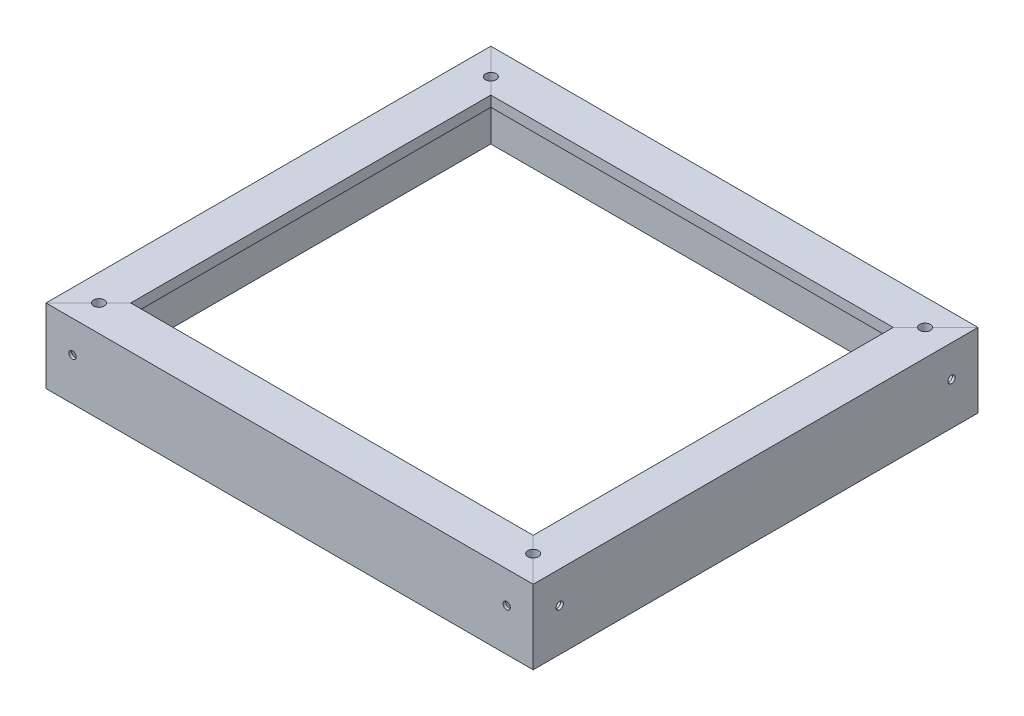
SolidWorks part; units mm, degrees
ref_plane "Front Plane" through (0, 0, 0) normal (0, 0, 1) x (1, 0, 0)
ref_plane "Top Plane" through (0, 0, 0) normal (0, 1, 0) x (1, 0, 0)
ref_plane "Right Plane" through (0, 0, 0) normal (1, 0, 0) x (0, 0, -1)
sketch "Sketch1" plane through (0, 0, 0) normal (0, 0, 1) x (1, 0, 0)
  line L0 (-73.025, 0) -> (-73.025, -22.225)
  line L1 (-73.025, 0) -> (-60.325, 0)
  line L2 (-69.85, -3.175) -> (-60.325, -3.175)
  line L3 (-69.85, -3.175) -> (-69.85, -22.225)
  line L4 (-60.325, 0) -> (-60.325, -3.175)
  line L5 (-69.85, -22.225) -> (-73.025, -22.225)
  dimension "D1" = 12.7
  dimension "D2" = 22.225
  dimension "D3" = 73.025
  dimension "D4" = 3.175
  dimension "D5" = 3.175
sketch "Sketch2" plane through (0, 0, 0) normal (0, 1, 0) x (1, 0, 0)
  line L1 (-73.025, 66.675) -> (73.025, 66.675)
  line L2 (-73.025, 66.675) -> (-73.025, -66.675)
  line L3 (-73.025, -66.675) -> (73.025, -66.675)
  line L4 (73.025, 66.675) -> (73.025, -66.675)
  line L5 (-73.025, 66.675) -> (73.025, -66.675) construction
  line L6 (-73.025, -66.675) -> (73.025, 66.675) construction
  point P1 (0, 0)
  dimension "D1" = 146.05
  dimension "D2" = 133.35
sweep "Sweep1" add profiles "Sketch1" path "Sketch2"
sketch "Sketch3" plane through (0, 0, 0) normal (0, 1, 0) x (1, 0, 0)
  line L2 (60.325, -53.975) -> (-60.325, -53.975) construction
  line L3 (-60.325, -53.975) -> (-60.325, 0) construction
  circle A0 centre (-65.0875, -58.7375) radius 1.59
  dimension "D1" = 3.1801
  dimension "D3" = 4.7625
  dimension "D2" = 4.7625
extrude "Cut-Extrude1" cut sketch "Sketch3" against normal through all
pattern_linear "LPattern1" count 2 spacing 130.175 along (1, 0, 0) count 2 spacing 117.475 along (0, 0, -1) of "Cut-Extrude1"
sketch "Sketch5" plane through (0, 0, 0) normal (0, 0, 1) x (1, 0, 0)
  line L6 (-73.025, 0) -> (-73.025, -22.225)
  line L7 (-73.025, -22.225) -> (-69.85, -22.225)
  line L8 (-69.85, -22.225) -> (-69.85, -3.175)
  line L9 (-69.85, -3.175) -> (-60.325, -3.175)
  line L10 (-60.325, -3.175) -> (-60.325, 0)
  line L11 (-60.325, 0) -> (-73.025, 0)
  line L12 (-73.025, 0) -> (-73.025, -22.225)
  line L13 (-73.025, -22.225) -> (-69.85, -22.225)
  line L14 (-69.85, -22.225) -> (-69.85, -3.175)
  line L15 (-69.85, -3.175) -> (-60.325, -3.175)
  line L16 (-60.325, -3.175) -> (-60.325, 0)
  line L17 (-60.325, 0) -> (-73.025, 0)
  dimension "D1" = 0
extrude "Boss-Extrude1" add sketch "Sketch5" along normal mid plane 2.54
ref_plane "Plane1" through (0, 0, 58.7248) normal (0, 0, 1) x (1, 0, 0)
sketch "Sketch6" plane through (0, 0, 58.7248) normal (0, 0, 1) x (1, 0, 0)
  line L0 (-69.85, -3.175) -> (-69.85, -22.225) construction
  line L1 (-69.85, -22.225) -> (69.85, -22.225) construction
  line B0 (-76.6251, -8.4298) -> (-76.6251, -9.525) construction
  line B1 (-69.85, -8.896) -> (-69.85, -9.525)
  line B2 (-72.2309, -8.435) -> (-72.2309, -9.525) construction
  line B3 (-72.2309, -8.435) -> (-76.6251, -8.4298)
  line B4 (-69.85, -7.1437) -> (-69.85, -8.896)
  line B5 (-72.2309, -8.435) -> (-69.85, -7.1437)
  line B6 (-69.85, -8.896) -> (-70.7252, -9.5198) construction
  line B7 (-70.7177, -9.525) -> (-70.7252, -9.5198)
  line B8 (-82.5895, -9.525) -> (-69.85, -9.525)
  ellipse B9 centre (-81.3837, -9.913) end of major axis (-81.3837, -9.2127) minor radius 0.5602 (-80.9963, -9.4071) -> (-81.8127, -9.4626) ccw
  ellipse B10 centre (-82.2906, -11.5744) end of major axis (-82.1007, -9.3588) minor radius 1.1214 (-81.8127, -9.4626) -> (-82.5895, -9.525) ccw
  ellipse B11 centre (-76.6528, -9.3774) end of major axis (-76.6528, -8.4292) minor radius 0.7586 (-76.6251, -8.4298) -> (-77.3955, -9.1841) ccw
  ellipse B12 centre (-78.4909, -9.2536) end of major axis (-78.4909, -8.7968) minor radius 0.3655 (-78.1444, -9.1085) -> (-78.8562, -9.2416) ccw
  ellipse B13 centre (-77.769, -9.131) end of major axis (-77.769, -8.6612) minor radius 0.3759 (-77.3955, -9.1841) -> (-78.1444, -9.1085) ccw
  ellipse B14 centre (-79.216, -9.3415) end of major axis (-79.216, -8.8809) minor radius 0.3686 (-78.8562, -9.2416) -> (-79.5796, -9.266) ccw
  ellipse B15 centre (-80.6327, -9.5928) end of major axis (-80.6327, -9.1018) minor radius 0.3928 (-80.2903, -9.3521) -> (-80.9963, -9.4071) ccw
  ellipse B16 centre (-79.9234, -9.4582) end of major axis (-79.9234, -8.9874) minor radius 0.3766 (-79.5796, -9.266) -> (-80.2903, -9.3521) ccw
  dimension "D1" = 12.7
sketch_block_instance "Block1-1"
sketch_block "Block1" parameters "D1"=2.3813, "D2"=12.7395, "D3"=0.7768, "D4"=0.8164, "D5"=0.7059, "D6"=12.7395
revolve "Cut-Revolve1" cut sketch "Sketch6" angle 360 about L8
pattern_linear "LPattern2" count 2 spacing 117.4496 along (0, 0, -1) of "Cut-Revolve1"
mirror "Mirror1" about plane through (0, 0, 0) normal (1, 0, 0) of "LPattern2", "Cut-Revolve1"
ref_plane "Plane3" through (-65.0748, 0, 0) normal (1, 0, 0) x (0, 0, -1)
sketch "Sketch7" plane through (-65.0748, 0, 0) normal (1, 0, 0) x (0, 0, -1)
  line L0 (-63.5, -22.225) -> (63.5, -22.225) construction
  line L1 (-63.5, -3.175) -> (-63.5, -22.225) construction
  line B0 (-70.2751, -8.4298) -> (-70.2751, -9.525) construction
  line B1 (-63.5, -8.896) -> (-63.5, -9.525)
  line B2 (-65.8809, -8.435) -> (-65.8809, -9.525) construction
  line B3 (-65.8809, -8.435) -> (-70.2751, -8.4298)
  line B4 (-63.5, -7.1437) -> (-63.5, -8.896)
  line B5 (-65.8809, -8.435) -> (-63.5, -7.1437)
  line B6 (-63.5, -8.896) -> (-64.3752, -9.5198) construction
  line B7 (-64.3677, -9.525) -> (-64.3752, -9.5198)
  line B8 (-76.2395, -9.525) -> (-63.5, -9.525)
  ellipse B9 centre (-75.0337, -9.913) end of major axis (-75.0337, -9.2127) minor radius 0.5602 (-74.6463, -9.4071) -> (-75.4627, -9.4626) ccw
  ellipse B10 centre (-75.9406, -11.5744) end of major axis (-75.7507, -9.3588) minor radius 1.1214 (-75.4627, -9.4626) -> (-76.2395, -9.525) ccw
  ellipse B11 centre (-70.3028, -9.3774) end of major axis (-70.3028, -8.4292) minor radius 0.7586 (-70.2751, -8.4298) -> (-71.0455, -9.1841) ccw
  ellipse B12 centre (-72.1409, -9.2536) end of major axis (-72.1409, -8.7968) minor radius 0.3655 (-71.7944, -9.1085) -> (-72.5062, -9.2416) ccw
  ellipse B13 centre (-71.419, -9.131) end of major axis (-71.419, -8.6612) minor radius 0.3759 (-71.0455, -9.1841) -> (-71.7944, -9.1085) ccw
  ellipse B14 centre (-72.866, -9.3415) end of major axis (-72.866, -8.8809) minor radius 0.3686 (-72.5062, -9.2416) -> (-73.2296, -9.266) ccw
  ellipse B15 centre (-74.2827, -9.5928) end of major axis (-74.2827, -9.1018) minor radius 0.3928 (-73.9403, -9.3521) -> (-74.6463, -9.4071) ccw
  ellipse B16 centre (-73.5734, -9.4582) end of major axis (-73.5734, -8.9874) minor radius 0.3766 (-73.2296, -9.266) -> (-73.9403, -9.3521) ccw
  dimension "D1" = 12.7
sketch_block_instance "Block1-1"
revolve "Cut-Revolve2" cut sketch "Sketch7" angle 360 about L8
pattern_linear "LPattern3" count 2 spacing 130.1496 along (1, 0, 0) of "Cut-Revolve2"
mirror "Mirror2" about plane through (0, 0, 0) normal (0, 0, 1) of "LPattern3", "Cut-Revolve2"
